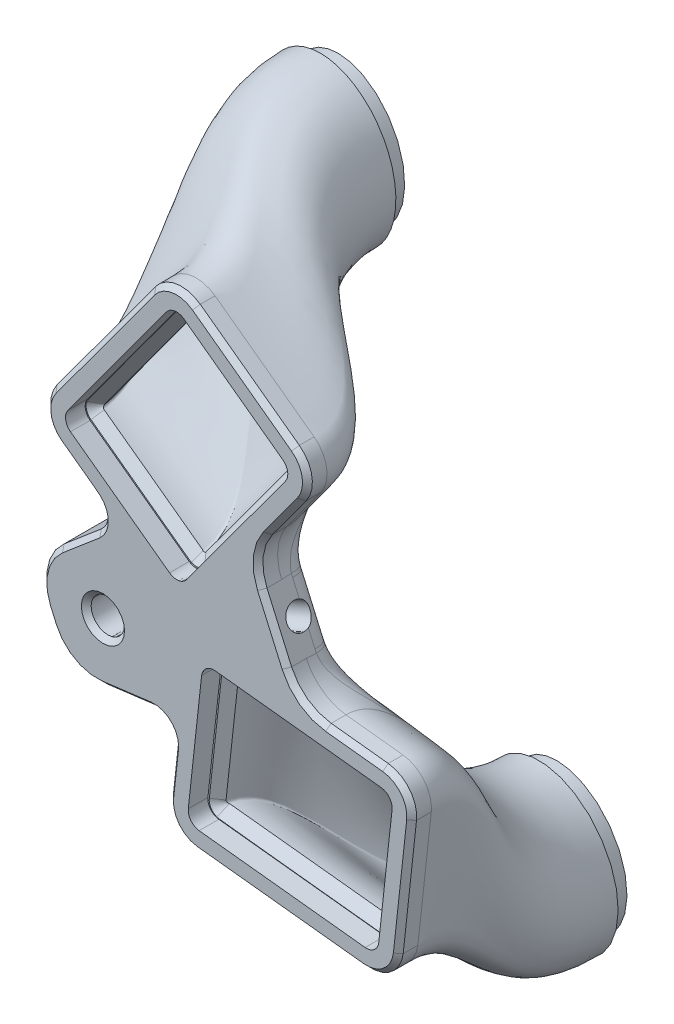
SolidWorks part; units mm, degrees
other "<NADMUCH-LEWY>-<<NADMUCH-PRAWY>-<Sfazowanie1>>"
other "<NADMUCH-PRAWY>-<Sfazowanie1>"
ref_plane "Płaszczyzna przednia" through (0, 0, 0) normal (0, 0, 1) x (1, 0, 0)
ref_plane "Płaszczyzna górna" through (0, 0, 0) normal (0, 1, 0) x (1, 0, 0)
ref_plane "Płaszczyzna prawa" through (0, 0, 0) normal (1, 0, 0) x (0, 0, -1)
sketch "Szkic1" plane through (0, 0, 0) normal (0, 0, 1) x (1, 0, 0)
  line L0 (-117.4156, 88.5402) -> (-111.9375, 84.5242)
  line L1 (-107.3949, 85.2237) -> (-102.5038, 91.8954)
  line L2 (-98.0433, 103.4768) -> (-108.1245, 110.8673) construction
  line L3 (-112.6672, 110.1677) -> (-122.7183, 96.4573) construction
  line L4 (-107.9601, 62.9247) -> (-91.061, 61.0755) construction
  line L5 (-87.4768, 63.9526) -> (-86.117, 76.3785) construction
  line L6 (-97.6699, 80.9121) -> (-105.8933, 81.812)
  line L7 (-109.4775, 78.9348) -> (-110.2165, 72.1826)
  line L8 (-117.4156, 88.5402) -> (-110.2165, 72.1826)
  line L9 (-102.5038, 91.8954) -> (-97.6699, 80.9121)
  line L10 (-100.0869, 86.4038) -> (-113.816, 80.3614) construction
  arc A0 (-122.7183, 96.4573) -> (-122.0187, 91.9147) centre (-120.0972, 94.5358) ccw construction
  arc A1 (-111.9375, 84.5242) -> (-107.3949, 85.2237) centre (-110.016, 87.1453) ccw
  arc A2 (-97.3438, 98.9342) -> (-98.0433, 103.4768) centre (-99.9649, 100.8557) ccw construction
  arc A3 (-108.1245, 110.8673) -> (-112.6672, 110.1677) centre (-110.0461, 108.2462) ccw construction
  arc A4 (-110.8373, 66.509) -> (-107.9601, 62.9247) centre (-107.6066, 66.1555) ccw construction
  arc A5 (-91.061, 61.0755) -> (-87.4768, 63.9526) centre (-90.7075, 64.3062) ccw construction
  arc A6 (-86.117, 76.3785) -> (-88.9942, 79.9627) centre (-89.3477, 76.732) ccw construction
  arc A7 (-105.8933, 81.812) -> (-109.4775, 78.9348) centre (-106.2468, 78.5813) ccw
  dimension "D1" = 19
  dimension "D2" = 15
  dimension "D3" = 12
extrude "Dodanie-wyciągnięcie1" add sketch "Szkic1" along normal blind 2
sketch "Szkic5-NADMUCH-PRAWY_Odbicie lustrzane-NADMUCH-LEWY" plane through (-165.4102, 130.6313, -20) normal (0, 0, -1) x (-0.4028, 0.9153, 0)
  ellipse E1 centre (-38.8831, 36.4011) end of major axis (-46.9612, 35.9523) minor radius 6.4945
  point P13 (-46.0626, 36.0022)
  point P14 (-45.2638, 36.0466)
  dimension "D1" = 0.9
  dimension "D2" = 1.7
sketch "Szkic6-NADMUCH-PRAWY_Odbicie lustrzane-NADMUCH-LEWY" plane through (-165.4102, 130.6313, 0) normal (0, 0, 1) x (0.4028, -0.9153, 0)
  line L4 (62.241, 32.9673) -> (51.4157, 26.7173)
  line L5 (51.0742, 26.8088) -> (42.5742, 41.5312)
  line L6 (42.6657, 41.8727) -> (53.491, 48.1227)
  line L7 (53.8325, 48.0312) -> (62.3325, 33.3088)
  line L8 (63.741, 30.3692) -> (52.9157, 24.1192)
  line L9 (48.4761, 25.3088) -> (39.9761, 40.0312)
  line L10 (41.1657, 44.4708) -> (51.991, 50.7208)
  line L11 (56.4306, 49.5312) -> (64.9306, 34.8088)
  line L12 (54.6985, 48.5312) -> (63.1985, 33.8088)
  line L13 (62.741, 32.1013) -> (51.9157, 25.8513)
  line L14 (50.2082, 26.3088) -> (41.7082, 41.0312)
  line L15 (42.1657, 42.7388) -> (52.991, 48.9888)
  arc A3 (51.0742, 26.8088) -> (51.4157, 26.7173) centre (51.2907, 26.9338) ccw
  arc A4 (42.6657, 41.8727) -> (42.5742, 41.5312) centre (42.7907, 41.6562) ccw
  arc A5 (53.8325, 48.0312) -> (53.491, 48.1227) centre (53.616, 47.9062) ccw
  arc A7 (62.241, 32.9673) -> (62.3325, 33.3088) centre (62.116, 33.1838) ccw
  arc A8 (48.4761, 25.3088) -> (52.9157, 24.1192) centre (51.2907, 26.9338) ccw
  arc A9 (41.1657, 44.4708) -> (39.9761, 40.0312) centre (42.7907, 41.6562) ccw
  arc A10 (56.4306, 49.5312) -> (51.991, 50.7208) centre (53.616, 47.9062) ccw
  arc A11 (63.741, 30.3692) -> (64.9306, 34.8088) centre (62.116, 33.1838) ccw
  arc A12 (62.741, 32.1013) -> (63.1985, 33.8088) centre (62.116, 33.1838) ccw
  arc A13 (50.2082, 26.3088) -> (51.9157, 25.8513) centre (51.2907, 26.9338) ccw
  arc A14 (42.1657, 42.7388) -> (41.7082, 41.0312) centre (42.7907, 41.6562) ccw
  arc A15 (54.6985, 48.5312) -> (52.991, 48.9888) centre (53.616, 47.9062) ccw
  dimension "D1" = 13
  dimension "D2" = 3
  dimension "D3" = 1
sketch "Szkic7-NADMUCH-PRAWY_Odbicie lustrzane-NADMUCH-LEWY" plane through (-165.4102, 130.6313, -20) normal (0, 0, 1) x (0.4028, -0.9153, 0)
  spline S2 degree 3 poles (44.8929, 34.3412) (45.4015, 36.039) (45.0841, 37.7826) (43.8573, 39.4712) (41.7698, 40.7588) (39.1569, 41.3297) (36.4968, 41.0517) (34.2796, 40.0033) (32.8733, 38.4611) (32.3646, 36.7633) (32.682, 35.0197) (33.9088, 33.3311) (35.9963, 32.0435) (38.6092, 31.4725) (41.2693, 31.7505) (43.4866, 32.7989) (44.8929, 34.3412) (45.4015, 36.039) (45.0841, 37.7826) knots -1.178097 -0.785398 -0.392699 0 0.392699 0.785398 1.178097 1.570796 1.963495 2.356194 2.748894 3.141593 3.534292 3.926991 4.31969 4.712389 5.105088 5.497787 5.890486 6.283185 6.675884 7.068583 7.461283 only from (45.2638, 36.0466) to (45.2638, 36.0466)
  spline S3 degree 3 poles (45.6017, 33.9122) (46.2344, 35.9927) (45.8361, 38.1305) (44.3975, 40.0871) (42.0647, 41.5178) (39.202, 42.1414) (36.2878, 41.8388) (33.8109, 40.6753) (32.1644, 38.8901) (31.5317, 36.8096) (31.9301, 34.6718) (33.3686, 32.7151) (35.7014, 31.2844) (38.5641, 30.6609) (41.4783, 30.9635) (43.9552, 32.1269) (45.6017, 33.9122) (46.2344, 35.9927) (45.8361, 38.1305) knots -1.178097 -0.785398 -0.392699 0 0.392699 0.785398 1.178097 1.570796 1.963495 2.356194 2.748894 3.141593 3.534292 3.926991 4.31969 4.712389 5.105088 5.497787 5.890486 6.283185 6.675884 7.068583 7.461283 only from (46.0626, 36.0022) to (46.0626, 36.0022)
sketch "Szkic8-NADMUCH-PRAWY_Odbicie lustrzane-NADMUCH-LEWY" plane through (-165.4102, 130.6313, 0) normal (0, 0, -1) x (-0.4028, 0.9153, 0)
  line L8 (-48.4761, 25.3088) -> (-39.9761, 40.0312)
  line L9 (-41.1657, 44.4708) -> (-51.991, 50.7208)
  line L10 (-56.4306, 49.5312) -> (-64.9306, 34.8088)
  line L11 (-63.741, 30.3692) -> (-52.9157, 24.1192)
  line L12 (-42.1657, 42.7388) -> (-52.991, 48.9888)
  line L13 (-54.6985, 48.5312) -> (-63.1985, 33.8088)
  line L14 (-62.741, 32.1013) -> (-51.9157, 25.8513)
  line L15 (-50.2082, 26.3088) -> (-41.7082, 41.0312)
  arc A8 (-52.9157, 24.1192) -> (-48.4761, 25.3088) centre (-51.2907, 26.9338) ccw
  arc A9 (-39.9761, 40.0312) -> (-41.1657, 44.4708) centre (-42.7907, 41.6562) ccw
  arc A10 (-51.991, 50.7208) -> (-56.4306, 49.5312) centre (-53.616, 47.9062) ccw
  arc A11 (-64.9306, 34.8088) -> (-63.741, 30.3692) centre (-62.116, 33.1838) ccw
  arc A12 (-52.991, 48.9888) -> (-54.6985, 48.5312) centre (-53.616, 47.9062) ccw
  arc A13 (-63.1985, 33.8088) -> (-62.741, 32.1013) centre (-62.116, 33.1838) ccw
  arc A14 (-51.9157, 25.8513) -> (-50.2082, 26.3088) centre (-51.2907, 26.9338) ccw
  arc A15 (-41.7082, 41.0312) -> (-42.1657, 42.7388) centre (-42.7907, 41.6562) ccw
inserted part "NADMUCH-LEWY"
move or copy body "Obiekt-Przenieś/Kopiuj2" placed by mates yes
sketch "Szkic5-NADMUCH-PRAWY" plane through (-111.5973, 8.3607, -20) normal (0, 0, 1) x (0.4028, -0.9153, 0)
  ellipse E1 centre (-38.8831, 36.4011) end of major axis (-46.9612, 35.9523) minor radius 6.4945
  point P13 (-46.0626, 36.0022)
  point P14 (-45.2638, 36.0466)
  dimension "D1" = 0.9
  dimension "D2" = 1.7
sketch "Szkic6-NADMUCH-PRAWY" plane through (-111.5973, 8.3607, 0) normal (0, 0, -1) x (-0.4028, 0.9153, 0)
  line L4 (62.241, 32.9673) -> (51.4157, 26.7173)
  line L5 (51.0742, 26.8088) -> (42.5742, 41.5312)
  line L6 (42.6657, 41.8727) -> (53.491, 48.1227)
  line L7 (53.8325, 48.0312) -> (62.3325, 33.3088)
  line L8 (63.741, 30.3692) -> (52.9157, 24.1192)
  line L9 (48.4761, 25.3088) -> (39.9761, 40.0312)
  line L10 (41.1657, 44.4708) -> (51.991, 50.7208)
  line L11 (56.4306, 49.5312) -> (64.9306, 34.8088)
  line L12 (54.6985, 48.5312) -> (63.1985, 33.8088)
  line L13 (62.741, 32.1013) -> (51.9157, 25.8513)
  line L14 (50.2082, 26.3088) -> (41.7082, 41.0312)
  line L15 (42.1657, 42.7388) -> (52.991, 48.9888)
  arc A3 (51.0742, 26.8088) -> (51.4157, 26.7173) centre (51.2907, 26.9338) ccw
  arc A4 (42.6657, 41.8727) -> (42.5742, 41.5312) centre (42.7907, 41.6562) ccw
  arc A5 (53.8325, 48.0312) -> (53.491, 48.1227) centre (53.616, 47.9062) ccw
  arc A7 (62.241, 32.9673) -> (62.3325, 33.3088) centre (62.116, 33.1838) ccw
  arc A8 (48.4761, 25.3088) -> (52.9157, 24.1192) centre (51.2907, 26.9338) ccw
  arc A9 (41.1657, 44.4708) -> (39.9761, 40.0312) centre (42.7907, 41.6562) ccw
  arc A10 (56.4306, 49.5312) -> (51.991, 50.7208) centre (53.616, 47.9062) ccw
  arc A11 (63.741, 30.3692) -> (64.9306, 34.8088) centre (62.116, 33.1838) ccw
  arc A12 (62.741, 32.1013) -> (63.1985, 33.8088) centre (62.116, 33.1838) ccw
  arc A13 (50.2082, 26.3088) -> (51.9157, 25.8513) centre (51.2907, 26.9338) ccw
  arc A14 (42.1657, 42.7388) -> (41.7082, 41.0312) centre (42.7907, 41.6562) ccw
  arc A15 (54.6985, 48.5312) -> (52.991, 48.9888) centre (53.616, 47.9062) ccw
  dimension "D1" = 13
  dimension "D2" = 3
  dimension "D3" = 1
sketch "Szkic7-NADMUCH-PRAWY" plane through (-111.5973, 8.3607, -20) normal (0, 0, -1) x (-0.4028, 0.9153, 0)
  spline S2 degree 3 poles (44.8929, 34.3412) (45.4015, 36.039) (45.0841, 37.7826) (43.8573, 39.4712) (41.7698, 40.7588) (39.1569, 41.3297) (36.4968, 41.0517) (34.2796, 40.0033) (32.8733, 38.4611) (32.3646, 36.7633) (32.682, 35.0197) (33.9088, 33.3311) (35.9963, 32.0435) (38.6092, 31.4725) (41.2693, 31.7505) (43.4866, 32.7989) (44.8929, 34.3412) (45.4015, 36.039) (45.0841, 37.7826) knots -1.178097 -0.785398 -0.392699 0 0.392699 0.785398 1.178097 1.570796 1.963495 2.356194 2.748894 3.141593 3.534292 3.926991 4.31969 4.712389 5.105088 5.497787 5.890486 6.283185 6.675884 7.068583 7.461283 only from (45.2638, 36.0466) to (45.2638, 36.0466)
  spline S3 degree 3 poles (45.6017, 33.9122) (46.2344, 35.9927) (45.8361, 38.1305) (44.3975, 40.0871) (42.0647, 41.5178) (39.202, 42.1414) (36.2878, 41.8388) (33.8109, 40.6753) (32.1644, 38.8901) (31.5317, 36.8096) (31.9301, 34.6718) (33.3686, 32.7151) (35.7014, 31.2844) (38.5641, 30.6609) (41.4783, 30.9635) (43.9552, 32.1269) (45.6017, 33.9122) (46.2344, 35.9927) (45.8361, 38.1305) knots -1.178097 -0.785398 -0.392699 0 0.392699 0.785398 1.178097 1.570796 1.963495 2.356194 2.748894 3.141593 3.534292 3.926991 4.31969 4.712389 5.105088 5.497787 5.890486 6.283185 6.675884 7.068583 7.461283 only from (46.0626, 36.0022) to (46.0626, 36.0022)
sketch "Szkic8-NADMUCH-PRAWY" plane through (-111.5973, 8.3607, 0) normal (0, 0, 1) x (0.4028, -0.9153, 0)
  line L8 (-48.4761, 25.3088) -> (-39.9761, 40.0312)
  line L9 (-41.1657, 44.4708) -> (-51.991, 50.7208)
  line L10 (-56.4306, 49.5312) -> (-64.9306, 34.8088)
  line L11 (-63.741, 30.3692) -> (-52.9157, 24.1192)
  line L12 (-42.1657, 42.7388) -> (-52.991, 48.9888)
  line L13 (-54.6985, 48.5312) -> (-63.1985, 33.8088)
  line L14 (-62.741, 32.1013) -> (-51.9157, 25.8513)
  line L15 (-50.2082, 26.3088) -> (-41.7082, 41.0312)
  arc A8 (-52.9157, 24.1192) -> (-48.4761, 25.3088) centre (-51.2907, 26.9338) ccw
  arc A9 (-39.9761, 40.0312) -> (-41.1657, 44.4708) centre (-42.7907, 41.6562) ccw
  arc A10 (-51.991, 50.7208) -> (-56.4306, 49.5312) centre (-53.616, 47.9062) ccw
  arc A11 (-64.9306, 34.8088) -> (-63.741, 30.3692) centre (-62.116, 33.1838) ccw
  arc A12 (-52.991, 48.9888) -> (-54.6985, 48.5312) centre (-53.616, 47.9062) ccw
  arc A13 (-63.1985, 33.8088) -> (-62.741, 32.1013) centre (-62.116, 33.1838) ccw
  arc A14 (-51.9157, 25.8513) -> (-50.2082, 26.3088) centre (-51.2907, 26.9338) ccw
  arc A15 (-41.7082, 41.0312) -> (-42.1657, 42.7388) centre (-42.7907, 41.6562) ccw
inserted part "NADMUCH-PRAWY"
move or copy body "Obiekt-Przenieś/Kopiuj6"
sketch "Szkic26" plane through (0, 0, 2) normal (0, 0, 1) x (1, 0, 0)
  line L0 (-117.4156, 88.5402) -> (-110.2165, 72.1826) construction
  line L1 (-107.4894, 78.7172) -> (-108.8492, 66.2914) construction
  line L2 (-89.2117, 77.9746) -> (-106.1109, 79.8239) construction
  line L3 (-97.6699, 80.9121) -> (-102.5038, 91.8954) construction
  line L4 (-98.9568, 100.1166) -> (-109.0078, 86.4062) construction
  line L5 (-119.0269, 92.2013) -> (-108.6051, 68.5215)
  line L6 (-107.4894, 78.7172) -> (-108.6051, 68.5215)
  line L7 (-96.7397, 78.7984) -> (-106.1109, 79.8239)
  line L8 (-96.7397, 78.7984) -> (-103.4341, 94.0092)
  line L9 (-103.4341, 94.0092) -> (-109.0078, 86.4062)
  line L10 (-98.9568, 100.1166) -> (-109.0078, 86.4062) construction
  line L11 (-110.755, 86.1371) -> (-120.8362, 93.5276) construction
  line L12 (-110.755, 86.1371) -> (-119.0269, 92.2013)
  line L13 (-110.755, 86.1371) -> (-120.8362, 93.5276) construction
  line L14 (-107.4894, 78.7172) -> (-108.8492, 66.2914) construction
  arc A0 (-106.1109, 79.8239) -> (-107.4894, 78.7172) centre (-106.2468, 78.5813) ccw construction
  arc A1 (-110.755, 86.1371) -> (-109.0078, 86.4062) centre (-110.016, 87.1453) ccw construction
  arc A2 (-106.1109, 79.8239) -> (-107.4894, 78.7172) centre (-106.2468, 78.5813) ccw
  arc A3 (-110.755, 86.1371) -> (-109.0078, 86.4062) centre (-110.016, 87.1453) ccw
extrude "Dodanie-wyciągnięcie2" add sketch "Szkic26" against normal blind 5
sketch "Szkic27" plane through (0, 0, -5) normal (0, 0, 1) x (1, 0, 0)
  line L1 (-124.8299, 80.4037) -> (-121.2243, 72.2112)
  line L2 (-123.0271, 76.3075) -> (-113.816, 80.3614) construction
  line L3 (-117.4156, 88.5402) -> (-110.2165, 72.1826) construction
  line L4 (-124.8299, 80.4037) -> (-116.8243, 87.1966)
  line L5 (-116.8243, 87.1966) -> (-110.8078, 73.5262)
  line L6 (-110.8078, 73.5262) -> (-121.2243, 72.2112)
  circle A1 centre (-117.5354, 78.7244) radius 1.7
  dimension "D4" = 3.4
  dimension "D1" = 10.0637
  dimension "D2" = 8.9509
  dimension "D3" = 33.12
  dimension "D5" = 4.0637
extrude "Dodanie-wyciągnięcie3" add sketch "Szkic27" along normal up to surface (7 mm away)
chamfer "Sfazowanie1" distance 2 angle 45 1 edges at (-113.816, 80.3614, -3)
fillet "Zaokrąglenie1" radius 5 15 edges at (-97.5351, 80.6058, -1.9458) (-106.5123, 81.0022, -3) (-109.7676, 71.1626, -3) (-121.2243, 72.2112, -1.5) (-124.8299, 80.4037, -1.5) (-110.0437, 84.7201, -3) (-116.0733, 88.6505, -3.7269) (-102.5565, 92.015, -1.244) (-117.8147, 89.4468, -2.8443)
fillet "Zaokrąglenie2" radius 2 2 edges at (-110.8078, 73.5262, -1.5) (-116.8243, 87.1966, -1.5)
fillet "Zaokrąglenie3" radius 2 2 edges at (-120.4056, 93.5088, -5.7352) (-109.4558, 70.2113, -5.0978)
fillet "Zaokrąglenie4" radius 2 5 edges at (-94.3931, 79.1048, -4.1018) (-101.67, 95.3316, -4.0415) (-100.0869, 86.4038, -3)
sketch "Szkic30" plane through (-51.9892, -22.8811, 0) normal (0.9153, 0.4028, 0) x (0, 0, -1)
  line L0 (-2, 116.2877) -> (-2, 122.5142) construction
  point P0 (0.5, 119.4009)
  point P3 (-2, 119.4009)
  dimension "D1" = 2.5
hole_wizard "Otwór gwintowany M31" positions "Szkic31" profile "Szkic32" tap size "M3" standard "DIN"
sketch "Szkic31" plane through (-51.9892, -22.8811, 0) normal (0.9153, 0.4028, 0) x (0, 0, -1)
  point P0 (0.5, 119.4009)
sketch "Szkic32" plane through (-100.0869, 86.4038, -0.5) normal (0, 0, 1) x (-0.4028, 0.9153, 0)
  line L0 (0, 0) -> (0, 15)
  line L1 (0, 15) -> (1.25, 14.2489)
  line L2 (1.25, 14.2489) -> (1.25, 0)
  line L5 (1.25, 0) -> (0, 0)
  line L10 (0, 15) -> (-1.25, 14.2489) construction
  line L11 (0, -6.35) -> (0, 107.95) construction
  dimension "Średnica wiertła gwintu" = 2.5
  dimension "Głębokość otworu gwintowanego" = 15
  dimension "Kąt wiertła" = 118
chamfer "Sfazowanie2" distance 0.5 angle 45 44 edges at (-110.1411, 64.121, 2) (-99.5106, 62.0001, 2) (-88.673, 61.7717, 2) (-86.7969, 70.1655, 2) (-86.8133, 78.7665, 2) (-91.8973, 80.2804, 2) (-115.8354, 78.7244, 2) (-100.0869, 86.4038, 2) (-120.2574, 90.6235, 2) (-115.054, 72.9902, 2) (-123.0271, 76.3075, 2) (-110.5998, 68.6799, 2) (-123.6237, 80.126, 2) (-120.6143, 73.2883, 2) (-97.2126, 81.5359, 2) (-101.7349, 91.8113, 2) (-118.3307, 89.2056, 2) (-110.3438, 71.0583, 2) (-120.0877, 84.4275, 2) (-110.9917, 72.8008, 2) (-117.4834, 87.551, 2) (-99.0704, 96.5789, 2) (-123.3093, 94.0411, 2) (-117.6927, 103.3125, 2) (-110.5407, 111.4583, 2) (-103.0839, 107.172, 2) (-96.7527, 101.3504, 2)
sketch "Szkic33" plane through (0, 0, -22) normal (0, 0, -1) x (-1, 0, 0)
  circle A0 centre (96.5151, 90.6921) radius 55.7978
extrude "Wytnij-wyciągnięcie1" cut sketch "Szkic33" against normal blind 0.2
